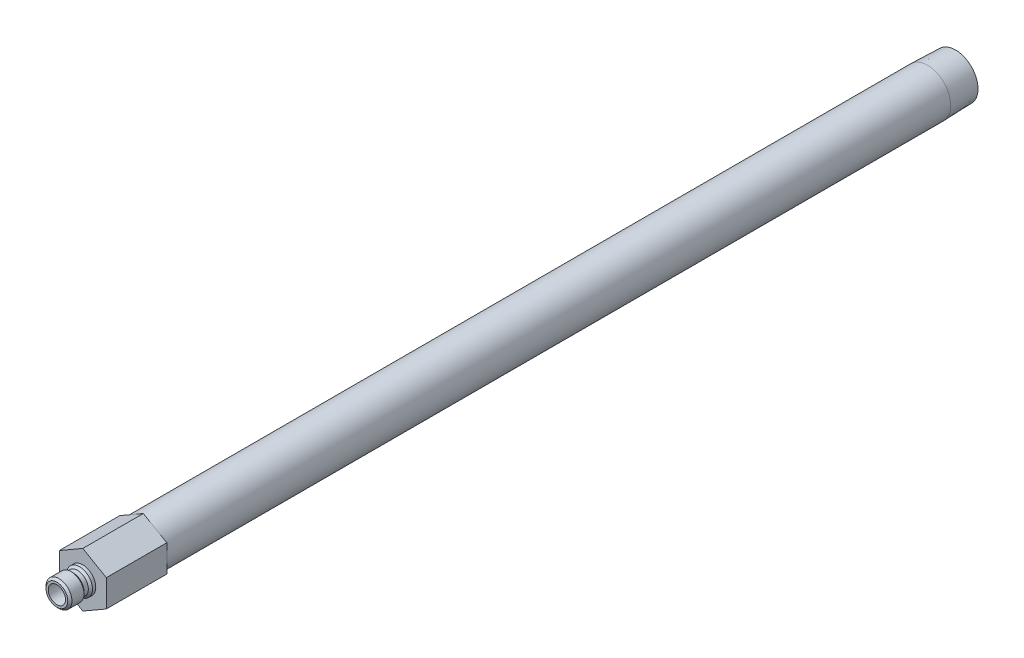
SolidWorks part; units mm, degrees
ref_plane "Front Plane" through (0, 0, 0) normal (0, 0, 1) x (1, 0, 0)
ref_plane "Top Plane" through (0, 0, 0) normal (0, 1, 0) x (1, 0, 0)
ref_plane "Right Plane" through (0, 0, 0) normal (1, 0, 0) x (0, 0, -1)
sketch "Sketch1" plane through (0, 0, 0) normal (1, 0, 0) x (0, 0, -1)
  line L0 (0, 0) -> (-12.7, 0) construction
  line L1 (-9.525, 3.175) -> (-9.525, 4.0005)
  line L2 (-3.556, 4.0005) -> (-3.556, 0) construction
  line L3 (-8.763, 4.7625) -> (-4.318, 4.7625)
  line L4 (0, 8.5725) -> (0, 0) construction
  line L5 (-3.556, 4.0005) -> (-1.9685, 4.0005)
  line L6 (-1.2065, 4.7625) -> (0, 4.7625)
  line L7 (0, 4.7625) -> (0, 8.5725)
  line L8 (-3.556, 4.0005) -> (-4.318, 4.7625)
  line L9 (-1.9685, 4.0005) -> (-1.2065, 4.7625)
  line L10 (-9.525, 4.0005) -> (-8.763, 4.7625)
  line L11 (-9.525, 3.175) -> (22.225, 3.175)
  line L12 (0, 8.5725) -> (310.3372, 8.5725)
  line L13 (310.3372, 8.5725) -> (320.675, 8.2494)
  line L14 (320.675, 8.2494) -> (320.675, 6.2611)
  line L15 (0, 0) -> (22.225, 0) construction
  line L16 (22.225, 0) -> (22.225, 3.175) construction
  line L17 (22.225, 4.7625) -> (0, 4.7625) construction
  line L18 (22.225, 3.175) -> (22.225, 6.2611)
  line L19 (22.225, 6.2611) -> (320.675, 6.2611)
  line L20 (22.225, 3.175) -> (22.225, 4.7625) construction
  dimension "D1" = 9.525
  dimension "D2" = 1.5875
  dimension "D3" = 0.762
  dimension "D4" = 45
  dimension "D5" = 5.969
  dimension "D6" = 45
  dimension "D7" = 1.79
  dimension "D8" = 10.3378
  dimension "D9" = 330.2
  dimension "D10" = 3.175
  dimension "D11" = 31.75
  dimension "D12" = 6.35
  dimension "D13" = 12.5222
  dimension "D14" = 9.525
  dimension "D15" = 17.145
revolve "Revolve1" add sketch "Sketch1" angle 360 about L0
sketch "Sketch2" plane through (0, 0, 0) normal (0, 0, 1) x (1, 0, 0)
  line L1 (-8.636, 4.986) -> (-8.636, -4.986)
  line L2 (-8.636, -4.986) -> (0, -9.972)
  line L3 (0, -9.972) -> (8.636, -4.986)
  line L4 (8.636, -4.986) -> (8.636, 4.986)
  line L5 (8.636, 4.986) -> (0, 9.972)
  line L6 (0, 9.972) -> (-8.636, 4.986)
  circle A0 centre (0, 0) radius 8.636 construction
  circle A1 centre (0, 0) radius 3.175 construction
  circle A2 centre (0, 0) radius 3.175
  dimension "D1" = 17.272
extrude "Boss-Extrude1" add sketch "Sketch2" against normal up to vertex (22.225 mm away) from vertex at 0
